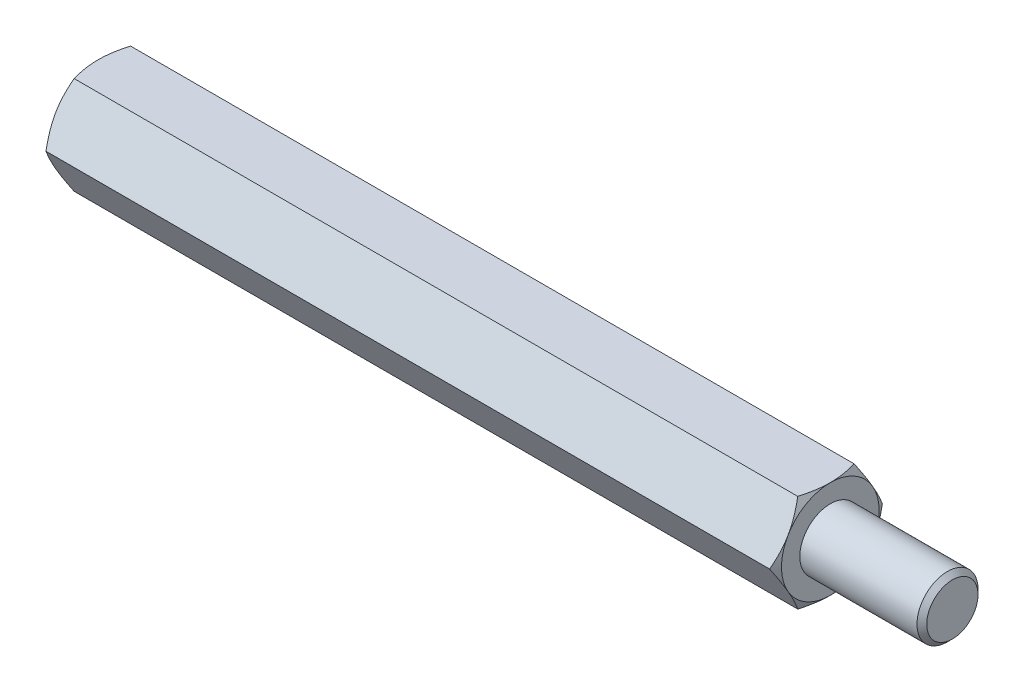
SolidWorks part; units mm, degrees
ref_plane "Front Plane" through (0, 0, 0) normal (0, 0, 1) x (1, 0, 0)
ref_plane "Top Plane" through (0, 0, 0) normal (0, 1, 0) x (1, 0, 0)
ref_plane "Right Plane" through (0, 0, 0) normal (1, 0, 0) x (0, 0, -1)
sketch "Sketch1" plane through (0, 0, 0) normal (1, 0, 0) x (0, 0, -1)
  line L1 (2.3094, 4) -> (-2.3094, 4)
  line L2 (-2.3094, 4) -> (-4.6188, 0)
  line L3 (-4.6188, 0) -> (-2.3094, -4)
  line L4 (-2.3094, -4) -> (2.3094, -4)
  line L5 (2.3094, -4) -> (4.6188, 0)
  line L6 (4.6188, 0) -> (2.3094, 4)
  circle A0 centre (0, 0) radius 4 construction
  dimension "D1" = 8
extrude "Extrude2" add sketch "Sketch1" along normal mid plane 60
sketch "Sketch2" plane through (0, 0, 0) normal (0, 0, 1) x (1, 0, 0)
  line L0 (-30, 4) -> (-28.5, 6.5981)
  line L1 (-30, 7) -> (-30, 4)
  line L3 (0, 0) -> (50000, 0) construction
  arc A0 (-28.5, 6.5981) -> (-30, 7) centre (-29.1962, 7) ccw
  dimension "D1" = 30
  dimension "D2" = 3
revolve "Cut-Revolve1" cut sketch "Sketch2" angle 360 about L3
mirror "Mirror1" about plane through (0, 0, 0) normal (1, 0, 0) of "Cut-Revolve1"
sketch "Sketch3" plane through (-30, 0, 0) normal (-1, 0, 0) x (0, 0, 1)
  circle A0 centre (0, 0) radius 2.1
  dimension "D1" = 4.2
extrude "Extrude3" cut sketch "Sketch3" against normal blind 10
sketch "Sketch4" plane through (0, 0, 0) normal (0, 0, 1) x (1, 0, 0)
  line L0 (-20, 0) -> (-20, 2.1)
  line L1 (29.6427, 0) -> (-29.6427, 0) construction
  line L2 (-20, 2.1) -> (-18.7876, 0)
  line L3 (-18.7876, 0) -> (-20, 0)
  line L4 (-30, 2) -> (-30, -2) construction
  point P4 (-30, 0)
  dimension "D1" = 30
  dimension "D2" = 2.1
  dimension "D3" = 10
revolve "Cut-Revolve2" cut sketch "Sketch4" angle 360 about L3
sketch "Sketch5" plane through (30, 0, 0) normal (1, 0, 0) x (0, 0, -1)
  circle A0 centre (0, 0) radius 2.5
  dimension "D1" = 5
extrude "Extrude4" add sketch "Sketch5" along normal blind 10
chamfer "Chamfer1" distance 0.4 angle 45 1 edges at (40, 0, -2.5)
equation "\"D2@Sketch4\" = \"D1@Sketch3\"/2"
